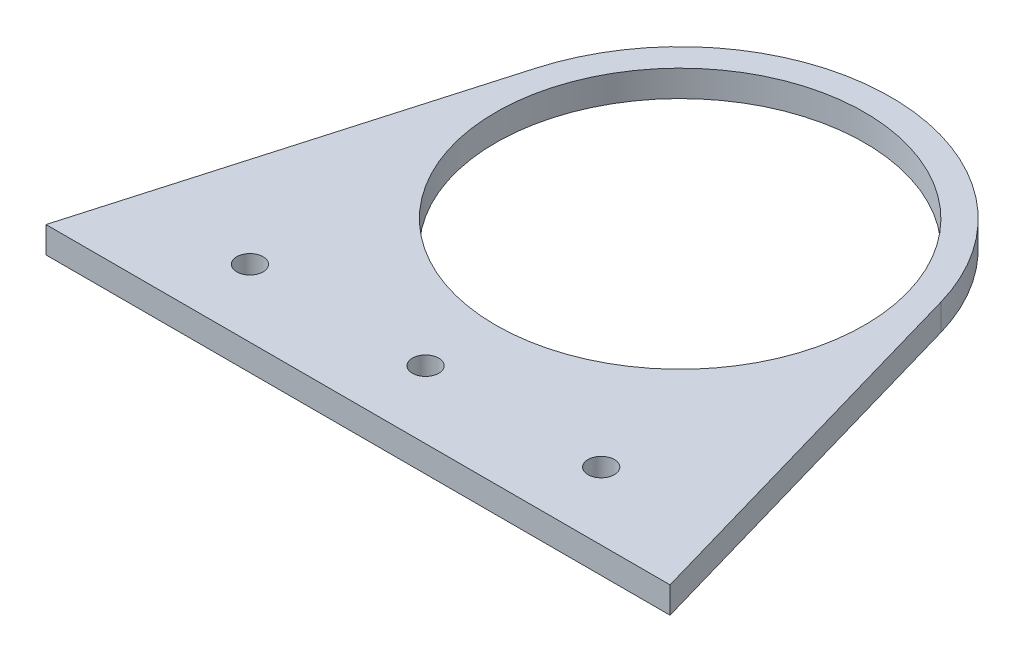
SolidWorks part; units mm, degrees
ref_plane "前视基准面" through (0, 0, 0) normal (0, 0, 1) x (1, 0, 0)
ref_plane "上视基准面" through (0, 0, 0) normal (0, 1, 0) x (1, 0, 0)
ref_plane "右视基准面" through (0, 0, 0) normal (1, 0, 0) x (0, 0, -1)
sketch "草图1" plane through (0, 0, 0) normal (0, 1, 0) x (1, 0, 0)
  line L0 (-17.3417, -38.526) -> (-4.8736, 4.7931)
  line L1 (41.2538, 4.7931) -> (53.722, -38.526)
  line L2 (-17.3417, -38.526) -> (53.722, -38.526)
  arc A0 (41.2538, 4.7931) -> (-4.8736, 4.7931) centre (18.1901, -1.8451) ccw
  circle A1 centre (18.1901, -1.8451) radius 21
  circle A2 centre (-1.8099, -30.835) radius 1.5
  circle A3 centre (18.1901, -30.835) radius 1.5
  circle A4 centre (38.1901, -30.835) radius 1.5
extrude "凸台-拉伸1" add sketch "草图1" along normal blind 3
